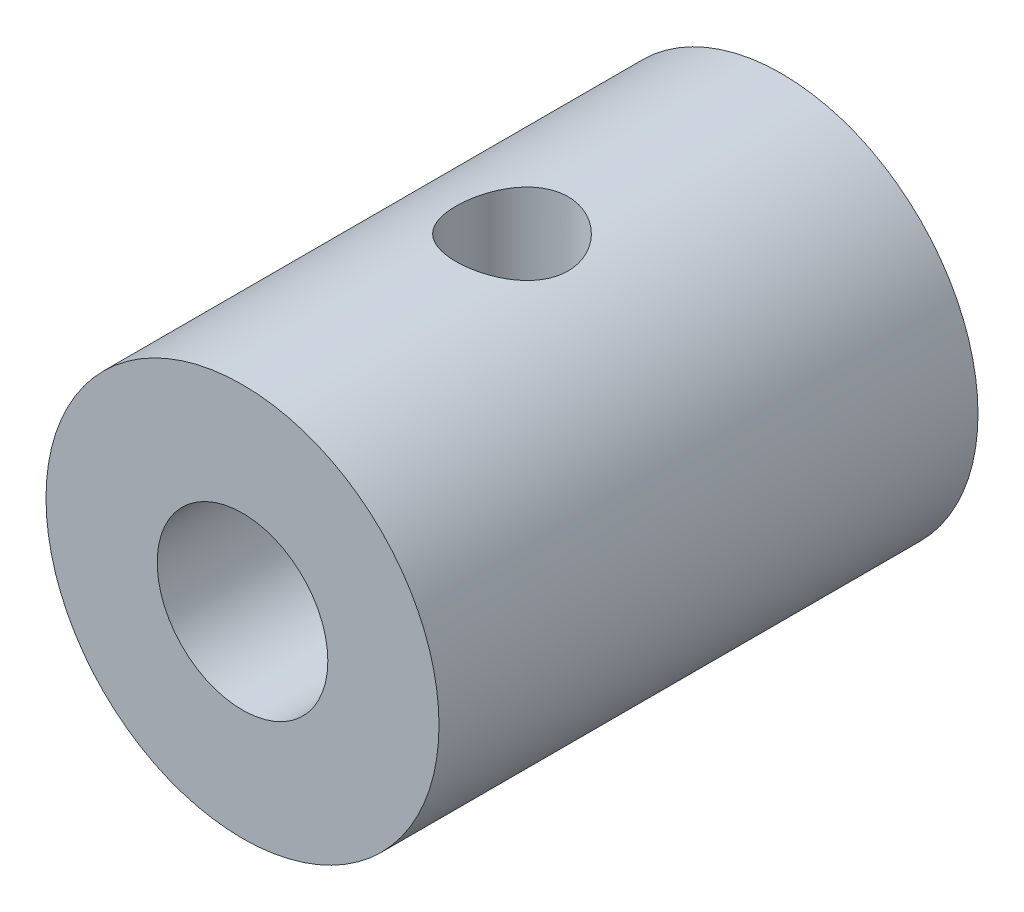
SolidWorks part; units mm, degrees
ref_plane "Front Plane" through (0, 0, 0) normal (0, 0, 1) x (1, 0, 0)
ref_plane "Top Plane" through (0, 0, 0) normal (0, 1, 0) x (1, 0, 0)
ref_plane "Right Plane" through (0, 0, 0) normal (1, 0, 0) x (0, 0, -1)
sketch "Sketch2" plane through (0, 0, 0) normal (0, 0, 1) x (1, 0, 0)
  circle A0 centre (0, 0) radius 2.413
  circle A1 centre (0, 0) radius 5.5562
  dimension "D1" = 11.1125
  dimension "D2" = 4.826
extrude "Boss-Extrude1" add sketch "Sketch2" against normal blind 15.24
sketch "Sketch3" plane through (0, 0, 0) normal (0, 1, 0) x (1, 0, 0)
  line L0 (0, 15.24) -> (0, 0) construction
  line L1 (2.413, 15.24) -> (-2.413, 15.24) construction
  line L2 (-5.5562, 0) -> (5.5562, 0) construction
  circle A0 centre (0, 7.62) radius 1.5875
  dimension "D2" = 3.175
  dimension "D1" = 7.62
extrude "Cut-Extrude1" cut sketch "Sketch3" against normal through all both and the other way through all
